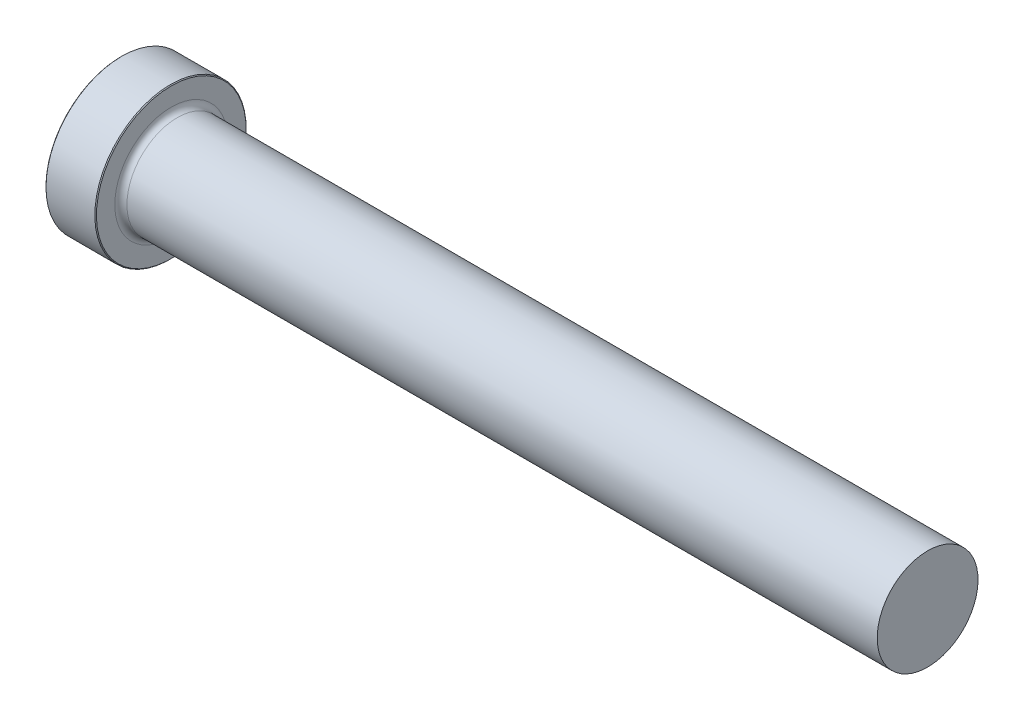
SolidWorks part; units mm, degrees
ref_plane "Front Plane" through (0, 0, 0) normal (0, 0, 1) x (1, 0, 0)
ref_plane "Top Plane" through (0, 0, 0) normal (0, 1, 0) x (1, 0, 0)
ref_plane "Right Plane" through (0, 0, 0) normal (1, 0, 0) x (0, 0, -1)
sketch "Sketch1" plane through (0, 0, 0) normal (0, 0, 1) x (1, 0, 0)
  line L0 (0, 0) -> (0, 9.525)
  line L1 (0, 9.525) -> (6.35, 9.525)
  line L2 (6.35, 9.525) -> (6.35, 7.1082)
  line L3 (7.112, 6.3462) -> (101.6, 6.3462)
  line L4 (101.6, 6.3462) -> (101.6, 0)
  line L5 (101.6, 0) -> (0, 0)
  line L6 (101.6, 0) -> (101.6, -6.3462) construction
  line L7 (101.6, -6.3462) -> (6.35, -6.3462) construction
  line L8 (0, 0) -> (0, -9.525) construction
  line L9 (0, -9.525) -> (6.35, -9.525) construction
  line L10 (6.35, -9.525) -> (6.35, -6.3462) construction
  arc A0 (6.35, 7.1082) -> (7.112, 6.3462) centre (7.112, 7.1082) ccw
  dimension "D4" = 0.762
  dimension "L" = 101.6
  dimension "D" = 12.6924
  dimension "H" = 19.05
  dimension "T" = 6.35
revolve "Revolve1" add sketch "Sketch1" angle 360 about L5
chamfer "Chamfer1" distance 0.1016 angle 45 2 edges at (0, 9.525, 0) (6.35, 9.525, 0)
